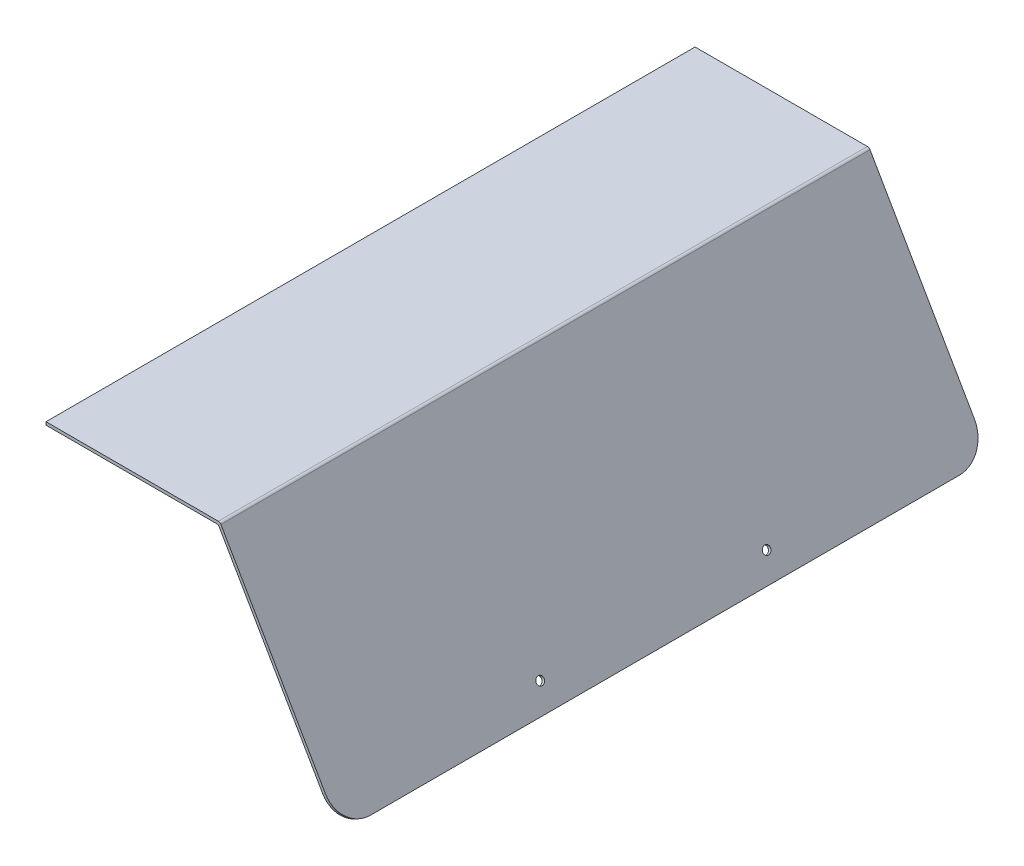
SolidWorks part; units mm, degrees
ref_plane "Plan de face" through (0, 0, 0) normal (0, 0, 1) x (1, 0, 0)
ref_plane "Plan de dessus" through (0, 0, 0) normal (0, 1, 0) x (1, 0, 0)
ref_plane "Plan de droite" through (0, 0, 0) normal (1, 0, 0) x (0, 0, -1)
sketch "Esquisse1" plane through (0, 0, 0) normal (0, 0, 1) x (1, 0, 0)
  line L0 (39, 135) -> (152, 135)
  line L1 (150, 135) -> (-30, 135) construction
  line L2 (153.7321, 134) -> (232.3544, -2.1778)
  line L3 (38, 134.2634) -> (38, 137) construction
  line L4 (39, 137) -> (153.1547, 137)
  line L5 (154.8868, 136) -> (234.0864, -1.1778)
  line L6 (39, 135) -> (39, 137)
  line L7 (232.3544, -2.1778) -> (234.0864, -1.1778)
  line L8 (150, 131) -> (150, 135) construction
  line L9 (39, 137) -> (154.3094, 137) construction
  line L10 (154.3094, 137) -> (234.0864, -1.1778) construction
  line L11 (39, 135) -> (153.1547, 135) construction
  line L12 (153.1547, 135) -> (232.3544, -2.1778) construction
  line L13 (150, 131) -> (150, 109) construction
  arc A0 (153.1547, 137) -> (154.8868, 136) centre (153.1547, 135) cw
  arc A1 (152, 135) -> (153.7321, 134) centre (152, 133) cw
  point P20 (150, 135)
  dimension "D1" = 2
  dimension "D2" = 120
  dimension "D3" = 160
  dimension "D4" = 1
  dimension "D6" = 2
  dimension "D5" = 2
extrude "Boss.-Extru.1" add sketch "Esquisse1" against normal up to surface (430 mm away)
fillet "Congé1" radius 20 2 edges at (233.2204, -1.6778, 0) (233.2204, -1.6778, -430)
ref_plane "Plan1" through (0, 0, -215) normal (0, 0, 1) x (1, 0, 0)
sketch "Esquisse3" plane through (175.0548, 101.0679, 0) normal (0.866, 0.5, 0) x (0, 0, -1)
  circle A0 centre (140, -102.7132) radius 2.5875 construction
  circle A1 centre (290, -102.7132) radius 2.5875 construction
  circle A2 centre (140, -102.7132) radius 2.5875
  circle A3 centre (290, -102.7132) radius 2.5875
extrude "Enlèv. mat.-Extru.2" cut sketch "Esquisse3" against normal up to surface (2 mm away)
